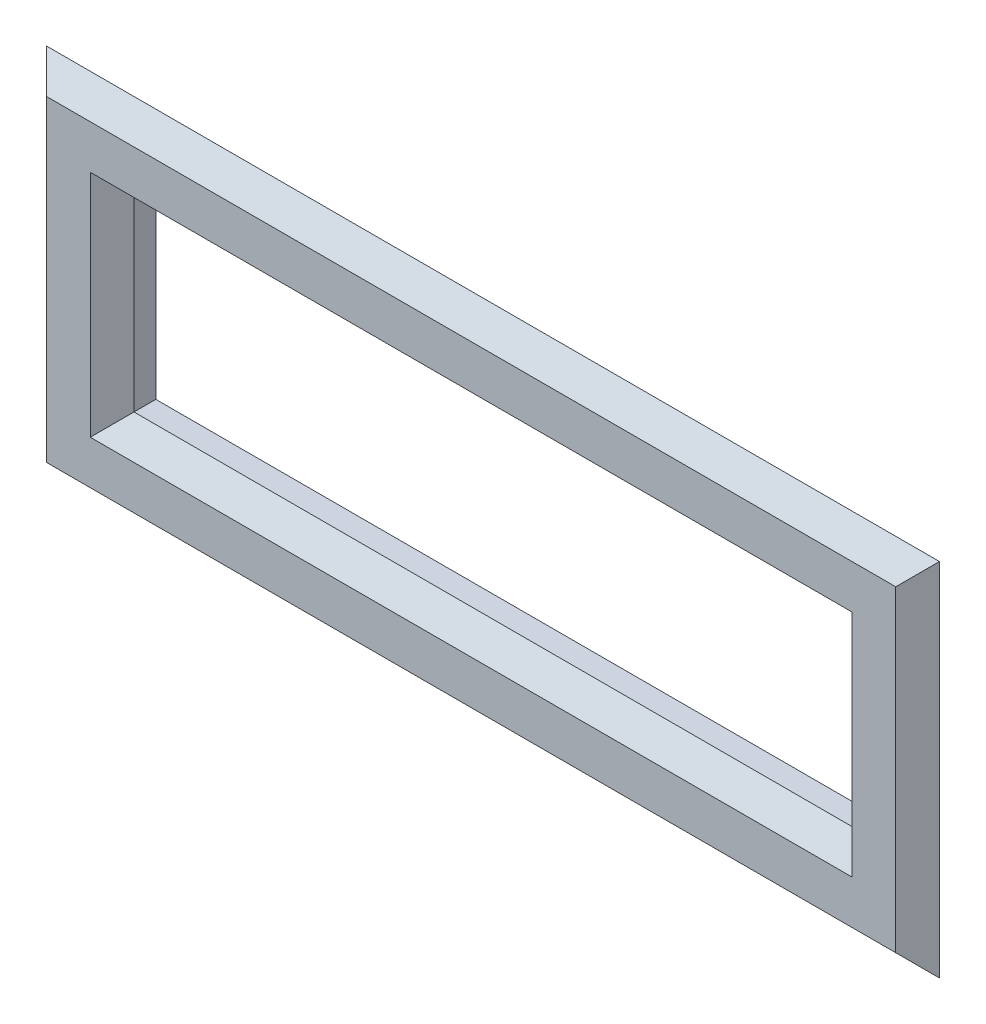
SolidWorks part; units mm, degrees
ref_plane "Ebene vorne" through (0, 0, 0) normal (0, 0, 1) x (1, 0, 0)
ref_plane "Ebene oben" through (0, 0, 0) normal (0, 1, 0) x (1, 0, 0)
ref_plane "Ebene rechts" through (0, 0, 0) normal (1, 0, 0) x (0, 0, -1)
sketch "Skizze1" plane through (0, 0, 0) normal (0, 0, 1) x (1, 0, 0)
  line L1 (-34.85, -10.5) -> (34.85, -10.5)
  line L2 (-34.85, -10.5) -> (-34.85, 10.5)
  line L3 (-34.85, 10.5) -> (34.85, 10.5)
  line L4 (34.85, -10.5) -> (34.85, 10.5)
  line L5 (-34.85, -10.5) -> (34.85, 10.5) construction
  line L6 (-34.85, 10.5) -> (34.85, -10.5) construction
  line L7 (-32.85, -8.5) -> (32.85, -8.5)
  line L8 (-32.85, -8.5) -> (-32.85, 8.5)
  line L9 (-32.85, 8.5) -> (32.85, 8.5)
  line L10 (32.85, -8.5) -> (32.85, 8.5)
  line L11 (-32.85, -8.5) -> (32.85, 8.5) construction
  line L12 (-32.85, 8.5) -> (32.85, -8.5) construction
  point P0 (0, 0)
  point P6 (0, 0)
  dimension "D1" = 69.7
  dimension "D2" = 2
  dimension "D3" = 21
  dimension "D4" = 2
extrude "Aufsatz-Linear austragen1" add sketch "Skizze1" along normal blind 2
sketch "Skizze2" plane through (0, 0, 2) normal (0, 0, 1) x (1, 0, 0)
  line L0 (0, 10.5) -> (0, -10.5) construction
  line L1 (34.85, 10.5) -> (-34.85, 10.5) construction
  line L2 (-34.85, -10.5) -> (34.85, -10.5) construction
  line L3 (-34.85, 0) -> (34.85, 0) construction
  line L4 (-34.85, 10.5) -> (-34.85, -10.5) construction
  line L5 (34.85, -10.5) -> (34.85, 10.5) construction
  line L6 (32.85, -8.5) -> (32.85, 8.5) construction
  line L7 (-32.85, -8.5) -> (32.85, -8.5)
  line L8 (-32.85, -8.5) -> (-32.85, 8.5)
  line L9 (-32.85, 8.5) -> (32.85, 8.5)
  line L10 (32.85, -8.5) -> (32.85, 8.5)
  line L11 (-32.85, -8.5) -> (32.85, 8.5) construction
  line L12 (-32.85, 8.5) -> (32.85, -8.5) construction
  line L14 (-40.85, -16.5) -> (40.85, -16.5)
  line L15 (-40.85, -16.5) -> (-40.85, 16.5)
  line L16 (-40.85, 16.5) -> (40.85, 16.5)
  line L17 (40.85, -16.5) -> (40.85, 16.5)
  line L18 (-40.85, -16.5) -> (40.85, 16.5) construction
  line L19 (-40.85, 16.5) -> (40.85, -16.5) construction
  point P12 (0, 0)
  point P20 (0, 0)
  dimension "D1" = 6
  dimension "D2" = 6
extrude "Aufsatz-Linear austragen3" add sketch "Skizze2" along normal blind 2 contours L15 L14 L17 L16 | L8 L7 L10 L9
chamfer "Fase1" distance 2 angle 45 8 edges at (40.85, 0, 4) (0, -16.5, 4) (-40.85, 0, 4) (0, 16.5, 4) (-32.85, 0, 4) (0, -8.5, 4) (32.85, 0, 4) (0, 8.5, 4)
